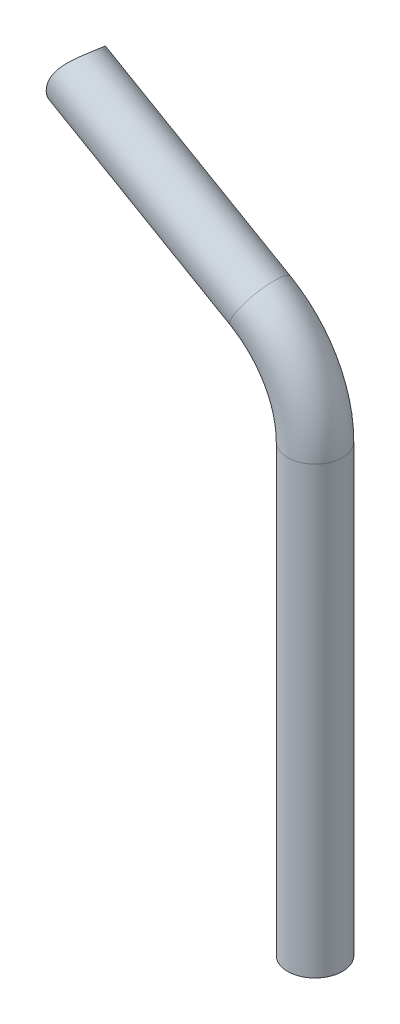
SolidWorks part; units mm, degrees
ref_plane "Plan de face" through (0, 0, 0) normal (0, 0, 1) x (1, 0, 0)
ref_plane "Plan de dessus" through (0, 0, 0) normal (0, 1, 0) x (1, 0, 0)
ref_plane "Plan de droite" through (0, 0, 0) normal (1, 0, 0) x (0, 0, -1)
sketch "Esquisse1" plane through (0, 0, 0) normal (0, 0, 1) x (1, 0, 0)
  line L0 (0, 0) -> (125, -72.1688)
  line L1 (155, -124.1303) -> (155, -367.4893)
  arc A0 (125, -72.1688) -> (155, -124.1303) centre (95, -124.1303) cw
  point P6 (155, -89.4893)
  dimension "D4" = 60
  dimension "D1" = 155
  dimension "D2" = 120
  dimension "D3" = 278
ref_plane "Plan1" through (0, -367.4893, 0) normal (0, 1, 0) x (-1, 0, 0)
sketch "Esquisse2" plane through (0, -367.4893, 0) normal (0, 1, 0) x (-1, 0, 0)
  circle A0 centre (-155, 0) radius 15
  circle A1 centre (-155, 0) radius 13
  dimension "D1" = 30
  dimension "D2" = 26
sweep "Balayage1" add profiles "Esquisse2" path "Esquisse1"
sketch "Esquisse3" plane through (8.7971, 20.0858, -6.9406) normal (0.3825, 0.8733, -0.3018) x (0.9231, -0.3471, 0.1656)
  circle A0 centre (0, 0) radius 30
  circle A1 centre (0, 0) radius 30 construction
extrude "Enlèv. mat.-Extru.1" cut sketch "Esquisse3" against normal blind 60
